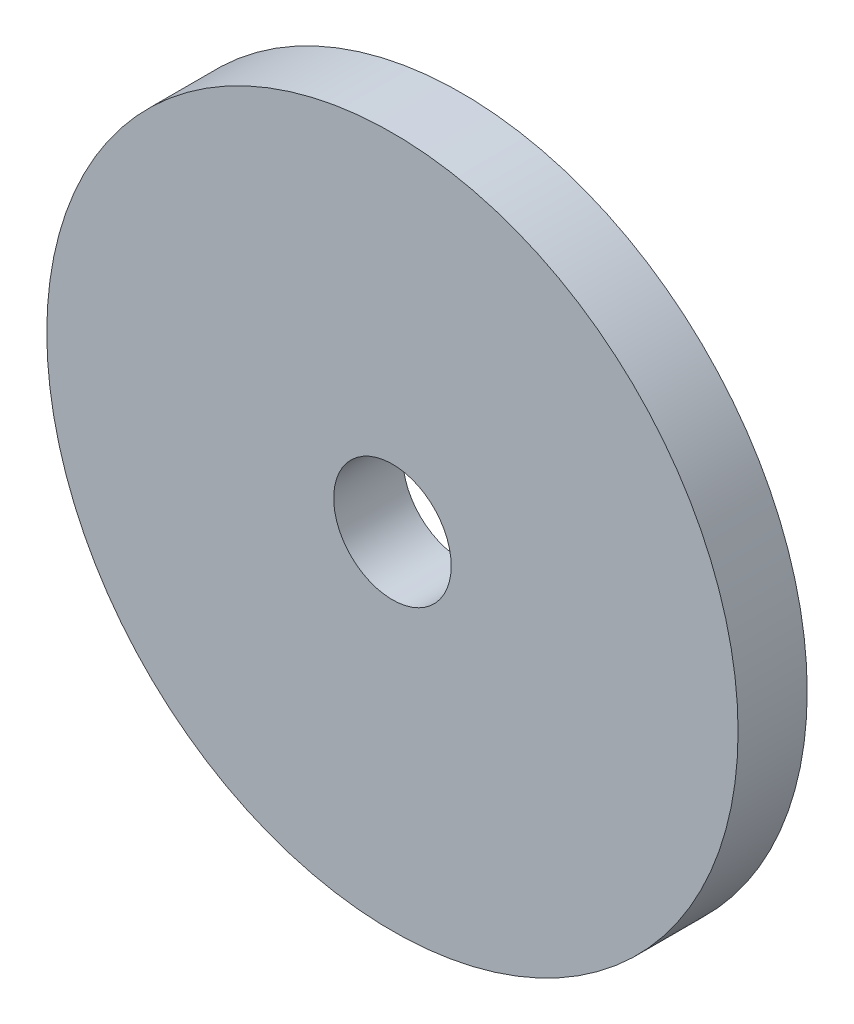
SolidWorks part; units mm, degrees
ref_plane "Face" through (0, 0, 0) normal (0, 0, 1) x (1, 0, 0)
ref_plane "Dessus" through (0, 0, 0) normal (0, 1, 0) x (1, 0, 0)
ref_plane "Droite" through (0, 0, 0) normal (1, 0, 0) x (0, 0, -1)
sketch "Esquisse1" plane through (0, 0, 0) normal (0, 0, 1) x (1, 0, 0)
  circle A0 centre (0, 0) radius 25
  circle A1 centre (0, 0) radius 4.25
  dimension "D1" = 50
  dimension "D2" = 8.5
extrude "Base-Extrusion" add sketch "Esquisse1" along normal blind 5
